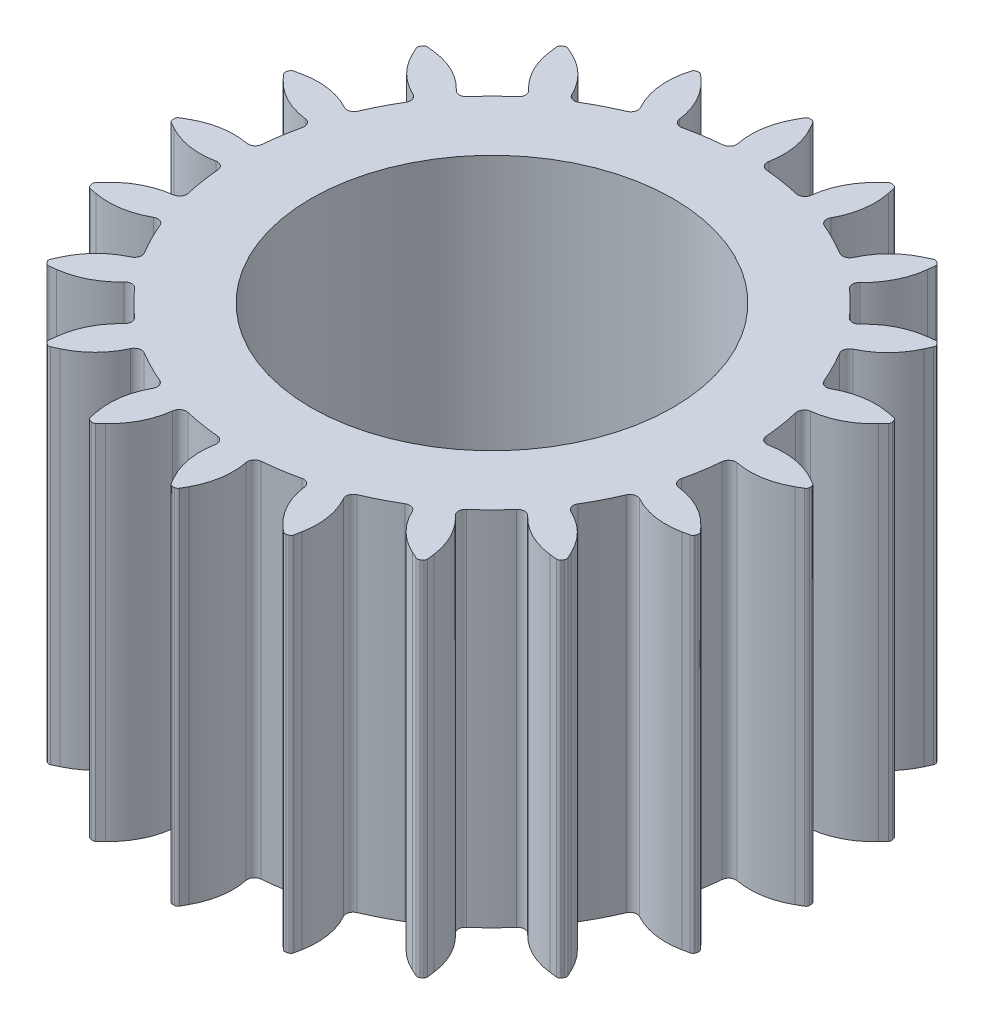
SolidWorks part; units mm, degrees
ref_plane "Front Plane" through (0, 0, 0) normal (0, 0, 1) x (1, 0, 0)
ref_plane "Top Plane" through (0, 0, 0) normal (0, 1, 0) x (1, 0, 0)
ref_plane "Right Plane" through (0, 0, 0) normal (1, 0, 0) x (0, 0, -1)
sketch "Sketch1" plane through (0, 0, 0) normal (0, 1, 0) x (1, 0, 0)
  line L0 (-3.7308, -46.7651) -> (-3.2515, -47.6051)
  line L1 (-1.6293, 39.0501) -> (-2.1085, 39.89)
  line L2 (-3.7171, 39.037) -> (-3.2483, 39.8829)
  line L3 (-2.8188, 40.1405) -> (-2.5412, 40.1422)
  line L4 (-14.9399, 37.2747) -> (-15.6552, 37.9255)
  line L5 (-16.9214, 36.6171) -> (-16.7371, 37.5665)
  line L6 (-16.4082, 37.9442) -> (-16.1447, 38.0316)
  line L7 (-27.0504, 31.4731) -> (-27.9319, 31.8709)
  line L8 (-28.7318, 30.2353) -> (-28.8498, 31.1952)
  line L9 (-28.6537, 31.6561) -> (-28.4302, 31.8206)
  line L10 (-36.7754, 22.213) -> (-37.7366, 22.319)
  line L11 (-37.992, 20.5163) -> (-38.4008, 21.3927)
  line L12 (-38.3568, 21.8916) -> (-38.195, 22.1172)
  line L13 (-43.1629, 10.401) -> (-44.1098, 10.2047)
  line L14 (-43.7956, 8.4113) -> (-44.4553, 9.1185)
  line L15 (-44.5675, 9.6066) -> (-44.4834, 9.8711)
  line L16 (-45.5876, -2.8068) -> (-46.4276, -3.286)
  line L17 (-45.5746, -4.8946) -> (-46.4205, -4.4258)
  line L18 (-46.6781, -3.9963) -> (-46.6798, -3.7187)
  line L19 (-43.8123, -16.1174) -> (-44.463, -16.8328)
  line L20 (-43.1547, -18.099) -> (-44.1041, -17.9146)
  line L21 (-44.4818, -17.5857) -> (-44.5692, -17.3222)
  line L22 (-38.0106, -28.2279) -> (-38.4085, -29.1094)
  line L23 (-36.7729, -29.9093) -> (-37.7328, -30.0273)
  line L24 (-38.1936, -29.8312) -> (-38.3582, -29.6077)
  line L25 (-28.7506, -37.9529) -> (-28.8566, -38.9142)
  line L26 (-27.0538, -39.1695) -> (-27.9303, -39.5783)
  line L27 (-28.4292, -39.5343) -> (-28.6547, -39.3725)
  line L28 (-16.9385, -44.3404) -> (-16.7423, -45.2874)
  line L29 (-14.9489, -44.9731) -> (-15.6561, -45.6328)
  line L30 (-16.1442, -45.7451) -> (-16.4087, -45.6609)
  line L31 (-2.1117, -47.598) -> (-1.643, -46.7521)
  line L33 (-2.5412, -47.8556) -> (-2.8188, -47.8573)
  line L34 (9.5798, -44.9898) -> (10.2952, -45.6406)
  line L35 (11.5614, -44.3322) -> (11.377, -45.2816)
  line L36 (11.0481, -45.6593) -> (10.7846, -45.7467)
  line L37 (21.6903, -39.1881) -> (22.5718, -39.586)
  line L38 (23.3717, -37.9504) -> (23.4897, -38.9103)
  line L39 (23.2937, -39.3711) -> (23.0701, -39.5357)
  line L40 (31.4153, -29.9281) -> (32.3766, -30.0341)
  line L41 (32.6319, -28.2314) -> (33.0408, -29.1078)
  line L42 (32.9967, -29.6067) -> (32.835, -29.8323)
  line L43 (37.8028, -18.1161) -> (38.7498, -17.9198)
  line L44 (38.4356, -16.1264) -> (39.0952, -16.8336)
  line L45 (39.2075, -17.3217) -> (39.1234, -17.5862)
  line L46 (40.2276, -4.9083) -> (41.0675, -4.429)
  line L47 (40.2145, -2.8205) -> (41.0604, -3.2892)
  line L48 (41.318, -3.7188) -> (41.3198, -3.9963)
  line L49 (38.4522, 8.4023) -> (39.103, 9.1177)
  line L50 (37.7947, 10.3839) -> (38.744, 10.1995)
  line L51 (39.1217, 9.8706) -> (39.2091, 9.6071)
  line L52 (32.6506, 20.5128) -> (33.0484, 21.3943)
  line L53 (31.4128, 22.1942) -> (32.3727, 22.3122)
  line L54 (32.8336, 22.1161) -> (32.9981, 21.8926)
  line L55 (23.3905, 30.2378) -> (23.4965, 31.1991)
  line L56 (21.6938, 31.4544) -> (22.5702, 31.8633)
  line L57 (23.0691, 31.8192) -> (23.2947, 31.6574)
  line L58 (11.5785, 36.6253) -> (11.3822, 37.5723)
  line L59 (9.5888, 37.2581) -> (10.296, 37.9177)
  line L60 (10.7841, 38.03) -> (11.0487, 37.9458)
  arc A0 (-36.7685, 4.078) -> (-37.5445, -0.7809) centre (-2.68, -3.8575) ccw
  arc A1 (-2.1085, 39.89) -> (-2.5412, 40.1422) centre (-2.5428, 39.6422) ccw
  arc A2 (-0.4973, 32.1932) -> (-1.6293, 39.0501) centre (-10.3149, 34.0943) ccw
  arc A3 (-2.8188, 40.1405) -> (-3.2483, 39.8829) centre (-2.811, 39.6406) ccw
  arc A4 (-3.7171, 39.037) -> (-4.772, 32.2092) centre (5.0299, 34.1902) ccw
  arc A5 (-15.6552, 37.9255) -> (-16.1447, 38.0316) centre (-15.9917, 37.5556) ccw
  arc A6 (-11.7444, 31.1033) -> (-14.9399, 37.2747) centre (-21.669, 29.8775) ccw
  arc A7 (-16.4082, 37.9442) -> (-16.7371, 37.5665) centre (-16.2462, 37.4711) ccw
  arc A8 (-16.6116, 37.8125) -> (-15.8148, 29.7976) centre (-7.1049, 34.7105) ccw
  arc A9 (-27.9319, 31.8709) -> (-28.4302, 31.8206) centre (-28.1375, 31.4152) ccw
  arc A10 (-22.1042, 26.5911) -> (-27.0504, 31.4731) centre (-31.1643, 22.3585) ccw
  arc A11 (-28.6537, 31.6561) -> (-28.8498, 31.1952) centre (-28.3535, 31.2562) ccw
  arc A12 (-28.7318, 30.2353) -> (-25.572, 24.0915) centre (-18.8065, 31.4555) ccw
  arc A13 (-37.7366, 22.319) -> (-38.195, 22.1172) centre (-37.7914, 21.822) ccw
  arc A14 (-30.5627, 19.0984) -> (-36.7754, 22.213) centre (-37.8714, 12.2732) ccw
  arc A15 (-38.3568, 21.8916) -> (-38.4008, 21.3927) centre (-37.9477, 21.6041) ccw
  arc A16 (-37.992, 20.5163) -> (-33.0883, 15.6496) centre (-28.9295, 24.7438) ccw
  arc A17 (-44.1098, 10.2047) -> (-44.4834, 9.8711) centre (-44.0084, 9.7151) ccw
  arc A18 (-36.2918, 9.3587) -> (-43.1629, 10.401) centre (-41.1337, 0.609) ccw
  arc A19 (-44.5675, 9.6066) -> (-44.4553, 9.1185) centre (-44.0897, 9.4596) ccw
  arc A20 (-43.7956, 8.4113) -> (-37.628, 5.2982) centre (-36.4831, 15.2324) ccw
  arc A21 (-46.4276, -3.286) -> (-46.6798, -3.7187) centre (-46.1798, -3.7203) ccw
  arc A22 (-38.7308, -1.6748) -> (-45.5876, -2.8068) centre (-40.6319, -11.4924) ccw
  arc A23 (-46.6781, -3.9963) -> (-46.4205, -4.4258) centre (-46.1781, -3.9885) ccw
  arc A24 (-45.5746, -4.8946) -> (-38.7468, -5.9495) centre (-40.7278, 3.8524) ccw
  arc A25 (-44.463, -16.8328) -> (-44.5692, -17.3222) centre (-44.0932, -17.1692) ccw
  arc A26 (-37.6408, -12.9219) -> (-43.8123, -16.1174) centre (-36.4151, -22.8465) ccw
  arc A27 (-44.4818, -17.5857) -> (-44.1041, -17.9146) centre (-44.0087, -17.4237) ccw
  arc A28 (-43.1547, -18.099) -> (-36.3351, -16.9923) centre (-41.2481, -8.2824) ccw
  arc A29 (-38.4085, -29.1094) -> (-38.3582, -29.6077) centre (-37.9527, -29.3151) ccw
  arc A30 (-33.1287, -23.2818) -> (-38.0106, -28.2279) centre (-28.896, -32.3418) ccw
  arc A31 (-38.1936, -29.8312) -> (-37.7328, -30.0273) centre (-37.7938, -29.531) ccw
  arc A32 (-36.7729, -29.9093) -> (-30.6291, -26.7495) centre (-37.9931, -19.984) ccw
  arc A33 (-28.8566, -38.9142) -> (-28.6547, -39.3725) centre (-28.3596, -38.969) ccw
  arc A34 (-25.636, -31.7402) -> (-28.7506, -37.9529) centre (-18.8108, -39.0489) ccw
  arc A35 (-28.4292, -39.5343) -> (-27.9303, -39.5783) centre (-28.1416, -39.1252) ccw
  arc A36 (-27.0538, -39.1695) -> (-22.1871, -34.2658) centre (-31.2814, -30.1071) ccw
  arc A37 (-16.7423, -45.2874) -> (-16.4087, -45.6609) centre (-16.2527, -45.1859) ccw
  arc A38 (-15.8962, -37.4693) -> (-16.9385, -44.3404) centre (-7.1466, -42.3112) ccw
  arc A39 (-16.1442, -45.7451) -> (-15.6561, -45.6328) centre (-15.9971, -45.2672) ccw
  arc A40 (-14.9489, -44.9731) -> (-11.8357, -38.8055) centre (-21.77, -37.6606) ccw
  arc A41 (-3.2515, -47.6051) -> (-2.8188, -47.8573) centre (-2.8172, -47.3573) ccw
  arc A42 (-4.8628, -39.9083) -> (-3.7308, -46.7651) centre (4.9548, -41.8094) ccw
  arc A43 (-2.5412, -47.8556) -> (-2.1117, -47.598) centre (-2.5491, -47.3556) ccw
  arc A44 (-1.643, -46.7521) -> (-0.5881, -39.9243) centre (-10.3899, -41.9053) ccw
  arc A45 (10.2952, -45.6406) -> (10.7846, -45.7467) centre (10.6316, -45.2707) ccw
  arc A46 (6.3843, -38.8184) -> (9.5798, -44.9898) centre (16.3089, -37.5926) ccw
  arc A47 (11.0481, -45.6593) -> (11.377, -45.2816) centre (10.8862, -45.1862) ccw
  arc A48 (11.5614, -44.3322) -> (10.4548, -37.5126) centre (1.7448, -42.4256) ccw
  arc A49 (22.5718, -39.586) -> (23.0701, -39.5357) centre (22.7775, -39.1303) ccw
  arc A50 (16.7442, -34.3062) -> (21.6903, -39.1881) centre (25.8042, -30.0735) ccw
  arc A51 (23.2937, -39.3711) -> (23.4897, -38.9103) centre (22.9935, -38.9713) ccw
  arc A52 (23.3717, -37.9504) -> (20.2119, -31.8066) centre (13.4464, -39.1706) ccw
  arc A53 (32.3766, -30.0341) -> (32.835, -29.8323) centre (32.4314, -29.5371) ccw
  arc A54 (25.2026, -26.8135) -> (31.4153, -29.9281) centre (32.5113, -19.9883) ccw
  arc A55 (32.9967, -29.6067) -> (33.0408, -29.1078) centre (32.5877, -29.3191) ccw
  arc A56 (32.6319, -28.2314) -> (27.7282, -23.3647) centre (23.5695, -32.4589) ccw
  arc A57 (38.7498, -17.9198) -> (39.1234, -17.5862) centre (38.6483, -17.4302) ccw
  arc A58 (30.9318, -17.0738) -> (37.8028, -18.1161) centre (35.7736, -8.3241) ccw
  arc A59 (39.2075, -17.3217) -> (39.0952, -16.8336) centre (38.7296, -17.1747) ccw
  arc A60 (38.4356, -16.1264) -> (32.268, -13.0132) centre (31.1231, -22.9475) ccw
  arc A61 (41.0675, -4.429) -> (41.3198, -3.9963) centre (40.8198, -3.9948) ccw
  arc A62 (33.3707, -6.0403) -> (40.2276, -4.9083) centre (35.2718, 3.7773) ccw
  arc A63 (41.318, -3.7188) -> (41.0604, -3.2892) centre (40.8181, -3.7266) ccw
  arc A64 (40.2145, -2.8205) -> (33.3867, -1.7656) centre (35.3677, -11.5674) ccw
  arc A65 (39.103, 9.1177) -> (39.2091, 9.6071) centre (38.7331, 9.4541) ccw
  arc A66 (32.2808, 5.2068) -> (38.4522, 8.4023) centre (31.055, 15.1314) ccw
  arc A67 (39.1217, 9.8706) -> (38.744, 10.1995) centre (38.6487, 9.7087) ccw
  arc A68 (37.7947, 10.3839) -> (30.9751, 9.2772) centre (35.888, 0.5673) ccw
  arc A69 (33.0484, 21.3943) -> (32.9981, 21.8926) centre (32.5927, 21.6) ccw
  arc A70 (27.7686, 15.5667) -> (32.6506, 20.5128) centre (23.536, 24.6267) ccw
  arc A71 (32.8336, 22.1161) -> (32.3727, 22.3122) centre (32.4337, 21.8159) ccw
  arc A72 (31.4128, 22.1942) -> (25.269, 19.0344) centre (32.633, 12.2689) ccw
  arc A73 (23.4965, 31.1991) -> (23.2947, 31.6574) centre (22.9995, 31.2539) ccw
  arc A74 (20.276, 24.0251) -> (23.3905, 30.2378) centre (13.4508, 31.3338) ccw
  arc A75 (23.0691, 31.8192) -> (22.5702, 31.8633) centre (22.7816, 31.4101) ccw
  arc A76 (21.6938, 31.4544) -> (16.8271, 26.5507) centre (25.9213, 22.392) ccw
  arc A77 (11.3822, 37.5723) -> (11.0487, 37.9458) centre (10.8926, 37.4708) ccw
  arc A78 (10.5362, 29.7543) -> (11.5785, 36.6253) centre (1.7865, 34.5961) ccw
  arc A79 (10.7841, 38.03) -> (10.296, 37.9177) centre (10.6371, 37.5521) ccw
  arc A80 (9.5888, 37.2581) -> (6.4757, 31.0904) centre (16.4099, 29.9455) ccw
  arc A107 (-11.7444, 31.1033) -> (-10.5277, 30.2513) centre (-10.7519, 31.2258) ccw
  arc A108 (-5.6668, 31.0148) -> (-4.772, 32.2092) centre (-5.7521, 32.0111) ccw
  arc A109 (-0.4973, 32.1932) -> (0.3966, 31.007) centre (0.4845, 32.0031) ccw
  arc A110 (-22.1042, 26.5911) -> (-20.6838, 26.1568) centre (-21.1982, 27.0144) ccw
  arc A111 (-30.5627, 19.0984) -> (-29.0776, 19.1243) centre (-29.8318, 19.781) ccw
  arc A112 (-16.2968, 28.385) -> (-15.8148, 29.7976) centre (-16.6858, 29.3063) ccw
  arc A113 (-25.5938, 22.5992) -> (-25.572, 24.0915) centre (-26.2485, 23.3551) ccw
  arc A114 (5.2555, 30.231) -> (6.4757, 31.0904) centre (5.4823, 31.2049) ccw
  arc A115 (10.5362, 29.7543) -> (11.0197, 28.3499) centre (11.4112, 29.2701) ccw
  arc A116 (15.4011, 26.1103) -> (16.8271, 26.5507) centre (15.9177, 26.9666) ccw
  arc A117 (20.276, 24.0251) -> (20.3019, 22.5401) centre (20.9585, 23.2943) ccw
  arc A118 (23.7767, 19.0562) -> (25.269, 19.0344) centre (24.5326, 19.7109) ccw
  arc A119 (27.7686, 15.5667) -> (27.3343, 14.1463) centre (28.1919, 14.6607) ccw
  arc A120 (29.5626, 9.7592) -> (30.9751, 9.2772) centre (30.4838, 10.1482) ccw
  arc A121 (32.2808, 5.2068) -> (31.4288, 3.9901) centre (32.4034, 4.2144) ccw
  arc A122 (32.1923, -0.8708) -> (33.3867, -1.7656) centre (33.1887, -0.7854) ccw
  arc A123 (33.3707, -6.0403) -> (32.1845, -6.9342) centre (33.1806, -7.0221) ccw
  arc A124 (31.4085, -11.7931) -> (32.268, -13.0132) centre (32.3824, -12.0198) ccw
  arc A125 (30.9318, -17.0738) -> (29.5274, -17.5573) centre (30.4476, -17.9487) ccw
  arc A126 (27.2879, -21.9386) -> (27.7282, -23.3647) centre (28.1441, -22.4552) ccw
  arc A127 (25.2026, -26.8135) -> (23.7176, -26.8394) centre (24.4718, -27.4961) ccw
  arc A128 (20.2338, -30.3143) -> (20.2119, -31.8066) centre (20.8884, -31.0702) ccw
  arc A129 (16.7442, -34.3062) -> (15.3238, -33.8719) centre (15.8382, -34.7295) ccw
  arc A130 (10.9367, -36.1001) -> (10.4548, -37.5126) centre (11.3258, -37.0213) ccw
  arc A131 (6.3843, -38.8184) -> (5.1677, -37.9664) centre (5.3919, -38.9409) ccw
  arc A132 (0.3067, -38.7299) -> (-0.5881, -39.9243) centre (0.3921, -39.7262) ccw
  arc A133 (-4.8628, -39.9083) -> (-5.7566, -38.7221) centre (-5.8445, -39.7182) ccw
  arc A134 (-10.6156, -37.9461) -> (-11.8357, -38.8055) centre (-10.8423, -38.92) ccw
  arc A135 (-15.8962, -37.4693) -> (-16.3798, -36.0649) centre (-16.7712, -36.9852) ccw
  arc A136 (-25.636, -31.7402) -> (-25.6619, -30.2551) centre (-26.3185, -31.0094) ccw
  arc A137 (-20.7611, -33.8254) -> (-22.1871, -34.2658) centre (-21.2777, -34.6817) ccw
  arc A138 (-29.1368, -26.7713) -> (-30.6291, -26.7495) centre (-29.8927, -27.426) ccw
  arc A139 (-33.1287, -23.2818) -> (-32.6944, -21.8614) centre (-33.552, -22.3757) ccw
  arc A140 (-34.9226, -17.4743) -> (-36.3351, -16.9923) centre (-35.8438, -17.8633) ccw
  arc A141 (-37.6408, -12.9219) -> (-36.7889, -11.7052) centre (-37.7634, -11.9295) ccw
  arc A142 (-32.6479, 14.2235) -> (-33.0883, 15.6496) centre (-33.5041, 14.7402) ccw
  arc A143 (-36.2918, 9.3587) -> (-34.8874, 9.8422) centre (-35.8076, 10.2336) ccw
  arc A144 (-36.7685, 4.078) -> (-37.628, 5.2982) centre (-37.7425, 4.3047) ccw
  arc A145 (-38.7308, -1.6748) -> (-37.5445, -0.7809) centre (-38.5407, -0.693) ccw
  arc A146 (-37.5524, -6.8443) -> (-38.7468, -5.9495) centre (-38.5487, -6.9297) ccw
  arc A149 (-5.6668, 31.0148) -> (-10.5277, 30.2513) centre (-2.68, -3.8575) ccw
  arc A150 (5.2555, 30.231) -> (0.3966, 31.007) centre (-2.68, -3.8575) ccw
  arc A151 (15.4011, 26.1103) -> (11.0197, 28.3499) centre (-2.68, -3.8575) ccw
  arc A152 (23.7767, 19.0562) -> (20.3019, 22.5401) centre (-2.68, -3.8575) ccw
  arc A153 (29.5626, 9.7592) -> (27.3343, 14.1463) centre (-2.68, -3.8575) ccw
  arc A154 (32.1923, -0.8708) -> (31.4288, 3.9901) centre (-2.68, -3.8575) ccw
  arc A155 (31.4085, -11.7931) -> (32.1845, -6.9342) centre (-2.68, -3.8575) ccw
  arc A156 (27.2879, -21.9386) -> (29.5274, -17.5573) centre (-2.68, -3.8575) ccw
  arc A157 (20.2338, -30.3143) -> (23.7176, -26.8394) centre (-2.68, -3.8575) ccw
  arc A158 (10.9367, -36.1001) -> (15.3238, -33.8719) centre (-2.68, -3.8575) ccw
  arc A159 (0.3067, -38.7299) -> (5.1677, -37.9664) centre (-2.68, -3.8575) ccw
  arc A160 (-10.6156, -37.9461) -> (-5.7566, -38.7221) centre (-2.68, -3.8575) ccw
  arc A161 (-20.7611, -33.8254) -> (-16.3798, -36.0649) centre (-2.68, -3.8575) ccw
  arc A162 (-29.1368, -26.7713) -> (-25.6619, -30.2551) centre (-2.68, -3.8575) ccw
  arc A163 (-34.9226, -17.4743) -> (-32.6944, -21.8614) centre (-2.68, -3.8575) ccw
  arc A164 (-37.5524, -6.8443) -> (-36.7889, -11.7052) centre (-2.68, -3.8575) ccw
  arc A165 (-32.6479, 14.2235) -> (-34.8874, 9.8422) centre (-2.68, -3.8575) ccw
  arc A166 (-25.5938, 22.5992) -> (-29.0776, 19.1243) centre (-2.68, -3.8575) ccw
  arc A167 (-16.2968, 28.385) -> (-20.6838, 26.1568) centre (-2.68, -3.8575) ccw
extrude "Boss-Extrude1" add sketch "Sketch1" along normal blind 50 contours A112 A167 A110 A10 L7 A9 L9 A11 L8 A12 A113 A166 A111 A14 L10 A13 L12 A15 L11 A16 A142 A165 A143 A18 L13 A17 L15 A19 L14 A20 A144 A0 A145 A22 L16 A21 L18 A23 L17 A24 A146 A164 A141 A26 L19 A25 L21 A27 L20 A28 A140
sketch "Sketch2" plane through (0, 50, 0) normal (0, 1, 0) x (1, 0, 0)
  circle A0 centre (-2.68, -3.8575) radius 25
  dimension "D1" = 50
extrude "Cut-Extrude1" cut sketch "Sketch2" against normal through all
